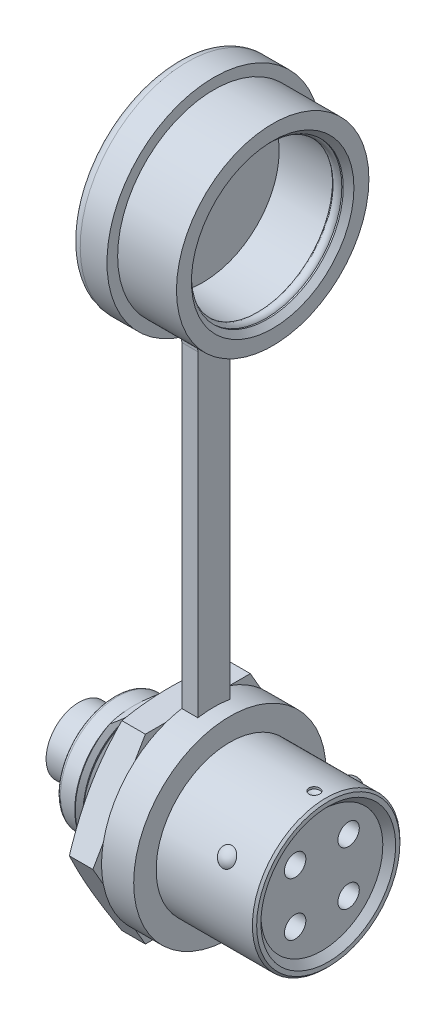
SolidWorks part; units mm, degrees
ref_plane "前视基准面" through (0, 0, 0) normal (0, 0, 1) x (1, 0, 0)
ref_plane "上视基准面" through (0, 0, 0) normal (0, 1, 0) x (1, 0, 0)
ref_plane "右视基准面" through (0, 0, 0) normal (1, 0, 0) x (0, 0, -1)
imported_body "输入1"
sketch "草图1" plane through (10.9, 0, 0) normal (1, 0, 0) x (0, 0, -1)
  line L1 (-2.5, 2.5) -> (2.5, 2.5) construction
  line L2 (-2.5, 2.5) -> (-2.5, -2.5) construction
  line L3 (-2.5, -2.5) -> (2.5, -2.5) construction
  line L4 (2.5, 2.5) -> (2.5, -2.5) construction
  line L5 (-2.5, 2.5) -> (2.5, -2.5) construction
  line L6 (-2.5, -2.5) -> (2.5, 2.5) construction
  circle A0 centre (-2.5, 2.5) radius 1
  circle A1 centre (2.5, 2.5) radius 1
  circle A2 centre (-2.5, -2.5) radius 1
  circle A3 centre (2.5, -2.5) radius 1
  point P0 (0, 0)
  dimension "D3" = 2
  dimension "D1" = 5
  dimension "D2" = 5
extrude "切除-拉伸1" cut sketch "草图1" against normal blind 4
